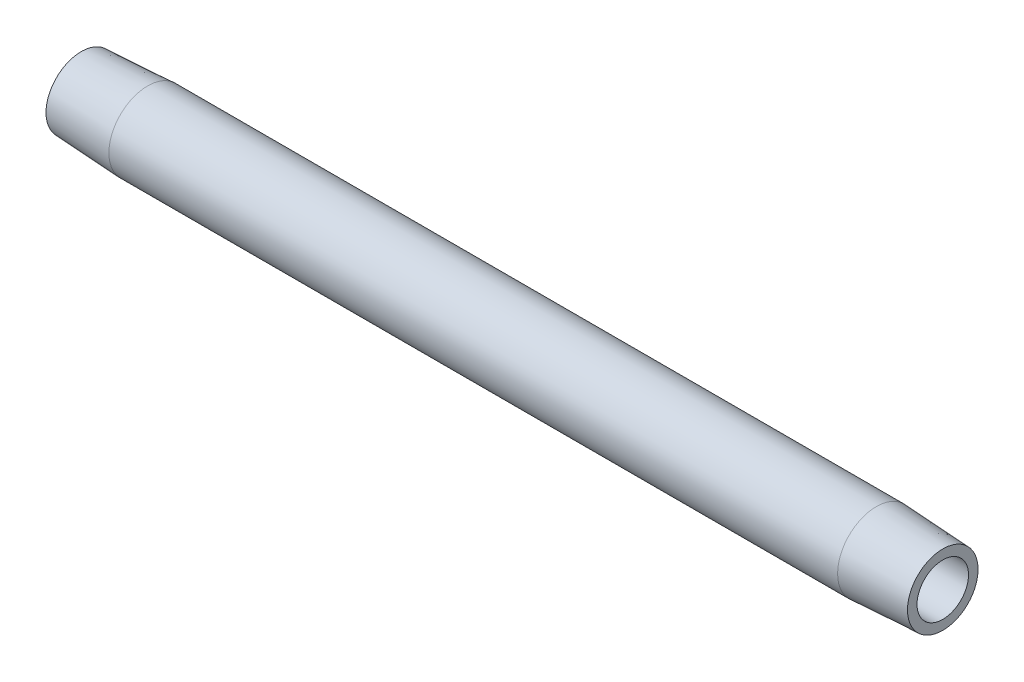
SolidWorks part; units mm, degrees
ref_plane "Front Plane" through (0, 0, 0) normal (0, 0, 1) x (1, 0, 0)
ref_plane "Top Plane" through (0, 0, 0) normal (0, 1, 0) x (1, 0, 0)
ref_plane "Right Plane" through (0, 0, 0) normal (1, 0, 0) x (0, 0, -1)
sketch "Sketch2" plane through (0, 0, 0) normal (0, 0, 1) x (1, 0, 0)
  line L0 (0.4761, 0) -> (50000.4761, 0) construction
  line L1 (0, -11.3625) -> (0, 49988.6375) construction
  line L7 (8.81, 5.1435) -> (0, 4.6818)
  line L8 (105.49, 5.1435) -> (8.81, 5.1435)
  line L9 (114.3, 4.6818) -> (105.49, 5.1435)
  line L10 (114.3, 3.4163) -> (114.3, 4.6818)
  line L11 (114.3, 3.4163) -> (0, 3.4163)
  line L12 (0, 4.6818) -> (0, 3.4163)
  dimension "D1" = 6.8326
  dimension "D2" = 10.287
  dimension "D3" = 3
  dimension "D4" = 3
  dimension "D5" = 8.81
  dimension "D6" = 8.81
  dimension "D7" = 114.3
revolve "Revolve1" add sketch "Sketch2" angle 360 about L0
